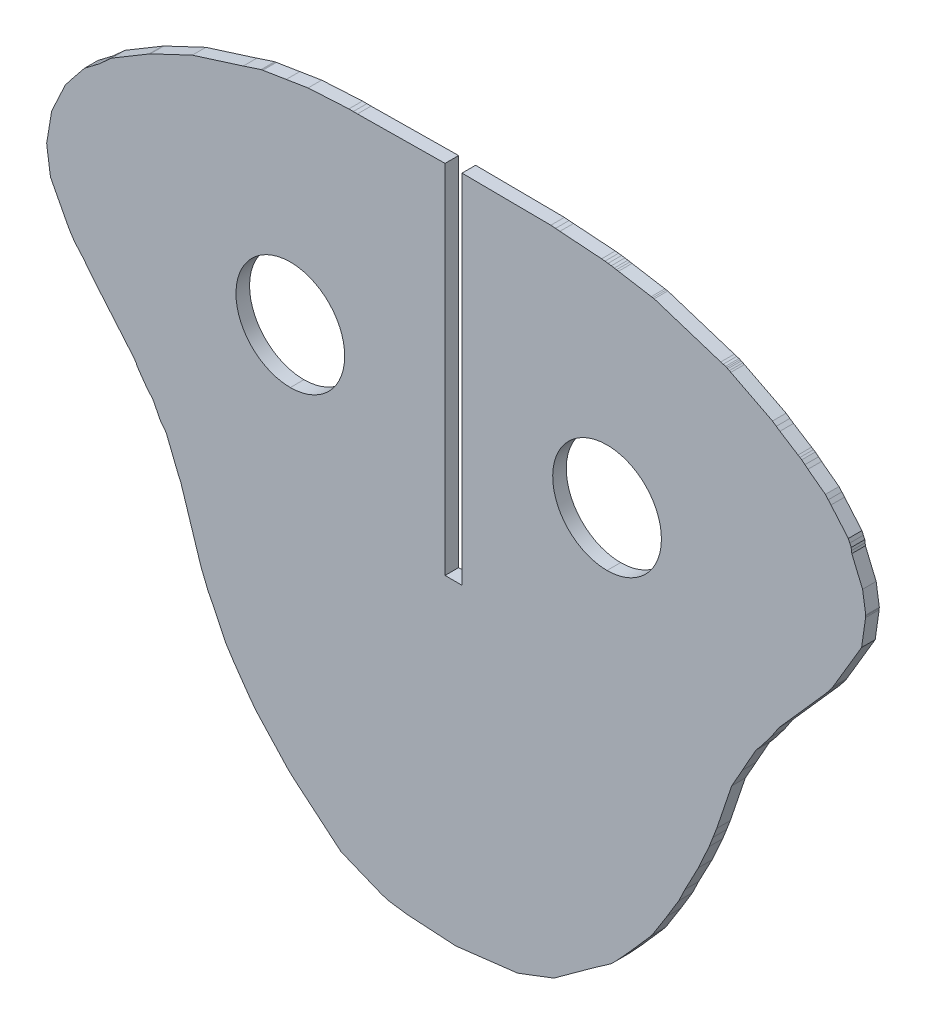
SolidWorks part; units mm, degrees
ref_plane "Спереди" through (0, 0, 0) normal (0, 0, 1) x (1, 0, 0)
ref_plane "Сверху" through (0, 0, 0) normal (0, 1, 0) x (1, 0, 0)
ref_plane "Справа" through (0, 0, 0) normal (1, 0, 0) x (0, 0, -1)
sketch "Model" plane through (0, 0, 0) normal (0, 0, 1) x (1, 0, 0)
  line L0 (-4228.3918, -765.8908) -> (-4227.7464, -765.9433)
  line L1 (-4227.7464, -765.9433) -> (-4221.6022, -766.3754)
  line L2 (-4221.6022, -766.3754) -> (-4221.1138, -766.4289)
  line L3 (-4221.1138, -766.4289) -> (-4220.6578, -766.4789)
  line L4 (-4220.6578, -766.4789) -> (-4220.1798, -766.5504)
  line L5 (-4220.1798, -766.5504) -> (-4219.7333, -766.6173)
  line L6 (-4219.7333, -766.6173) -> (-4219.4218, -766.6754)
  line L7 (-4219.4218, -766.6754) -> (-4219.1308, -766.7299)
  line L8 (-4219.1308, -766.7299) -> (-4214.2924, -767.5387)
  line L9 (-4214.2924, -767.5387) -> (-4214.0734, -767.5724)
  line L10 (-4214.0734, -767.5724) -> (-4213.8685, -767.6042)
  line L11 (-4213.8685, -767.6042) -> (-4204.0663, -770.7607)
  line L12 (-4204.0663, -770.7607) -> (-4203.7112, -770.8678)
  line L13 (-4203.7112, -770.8678) -> (-4203.3777, -770.9687)
  line L14 (-4203.3777, -770.9687) -> (-4203.2023, -771.0421)
  line L15 (-4203.2023, -771.0421) -> (-4203.0374, -771.1115)
  line L16 (-4203.0374, -771.1115) -> (-4202.8036, -771.2321)
  line L17 (-4202.8036, -771.2321) -> (-4202.5838, -771.3456)
  line L18 (-4202.5838, -771.3456) -> (-4196.4529, -774.4787)
  line L19 (-4196.4529, -774.4787) -> (-4195.8908, -774.8703)
  line L20 (-4195.8908, -774.8703) -> (-4195.3596, -775.2401)
  line L21 (-4195.3596, -775.2401) -> (-4192.6938, -776.9335)
  line L22 (-4192.6938, -776.9335) -> (-4192.411, -777.1046)
  line L23 (-4192.411, -777.1046) -> (-4192.1429, -777.2665)
  line L24 (-4192.1429, -777.2665) -> (-4191.6747, -777.6547)
  line L25 (-4191.6747, -777.6547) -> (-4191.2305, -778.0231)
  line L26 (-4191.2305, -778.0231) -> (-4188.6674, -779.9355)
  line L27 (-4188.6674, -779.9355) -> (-4188.2435, -780.4179)
  line L28 (-4188.2435, -780.4179) -> (-4187.8398, -780.8771)
  line L29 (-4187.8398, -780.8771) -> (-4185.2854, -783.8681)
  line L30 (-4185.2854, -783.8681) -> (-4185.073, -784.3488)
  line L31 (-4185.073, -784.3488) -> (-4184.8697, -784.8092)
  line L32 (-4184.8697, -784.8092) -> (-4184.8192, -785.185)
  line L33 (-4184.8192, -785.185) -> (-4184.7709, -785.5453)
  line L34 (-4184.7709, -785.5453) -> (-4183.1897, -789.2968)
  line L35 (-4183.1897, -789.2968) -> (-4182.7238, -792.3534)
  line L36 (-4182.7238, -792.3534) -> (-4182.7305, -792.4281)
  line L37 (-4182.7305, -792.4281) -> (-4182.737, -792.5004)
  line L38 (-4182.737, -792.5004) -> (-4182.7465, -792.6867)
  line L39 (-4182.7465, -792.6867) -> (-4183.3308, -796.7895)
  line L40 (-4183.3308, -796.7895) -> (-4187.5105, -803.8466)
  line L41 (-4187.5105, -803.8466) -> (-4187.6112, -804.0138)
  line L42 (-4187.6112, -804.0138) -> (-4187.7103, -804.1784)
  line L43 (-4187.7103, -804.1784) -> (-4188.6076, -805.3053)
  line L44 (-4188.6076, -805.3053) -> (-4195.4706, -813.059)
  line L45 (-4195.4706, -813.059) -> (-4196.6727, -814.8629)
  line L46 (-4196.6727, -814.8629) -> (-4198.13, -816.7629)
  line L47 (-4198.13, -816.7629) -> (-4198.9062, -817.6806)
  line L48 (-4198.9062, -817.6806) -> (-4200.8898, -821.2216)
  line L49 (-4200.8898, -821.2216) -> (-4202.4613, -824.006)
  line L50 (-4202.4613, -824.006) -> (-4204.6601, -830.5229)
  line L51 (-4204.6601, -830.5229) -> (-4205.2132, -831.9425)
  line L52 (-4205.2132, -831.9425) -> (-4205.7795, -833.3964)
  line L53 (-4205.7795, -833.3964) -> (-4207.3495, -836.872)
  line L54 (-4207.3495, -836.872) -> (-4209.3335, -840.644)
  line L55 (-4209.3335, -840.644) -> (-4210.2274, -842.5021)
  line L56 (-4210.2274, -842.5021) -> (-4211.9523, -845.3485)
  line L57 (-4211.9523, -845.3485) -> (-4214.1377, -848.8188)
  line L58 (-4214.1377, -848.8188) -> (-4214.4244, -849.162)
  line L59 (-4214.4244, -849.162) -> (-4214.725, -849.5219)
  line L60 (-4214.725, -849.5219) -> (-4217.6237, -852.8183)
  line L61 (-4217.6237, -852.8183) -> (-4219.506, -854.851)
  line L62 (-4219.506, -854.851) -> (-4219.834, -855.1816)
  line L63 (-4219.834, -855.1816) -> (-4220.1809, -855.5309)
  line L64 (-4220.1809, -855.5309) -> (-4220.9488, -856.0722)
  line L65 (-4220.9488, -856.0722) -> (-4221.7621, -856.6452)
  line L66 (-4221.7621, -856.6452) -> (-4221.9884, -856.7939)
  line L67 (-4221.9884, -856.7939) -> (-4222.2284, -856.9518)
  line L68 (-4222.2284, -856.9518) -> (-4228.5113, -861.506)
  line L69 (-4228.5113, -861.506) -> (-4228.632, -861.5717)
  line L70 (-4228.632, -861.5717) -> (-4228.7609, -861.6418)
  line L71 (-4228.7609, -861.6418) -> (-4233.1522, -863.3234)
  line L72 (-4233.1522, -863.3234) -> (-4233.5634, -863.4716)
  line L73 (-4233.5634, -863.4716) -> (-4234.0035, -863.63)
  line L74 (-4234.0035, -863.63) -> (-4242.5676, -864.6535)
  line L75 (-4242.5676, -864.6535) -> (-4242.7355, -864.672)
  line L76 (-4242.7355, -864.672) -> (-4242.9154, -864.6921)
  line L77 (-4242.9154, -864.6921) -> (-4243.0228, -864.6991)
  line L78 (-4243.0228, -864.6991) -> (-4243.1307, -864.6996)
  line L79 (-4243.1307, -864.6996) -> (-4243.2463, -864.7001)
  line L80 (-4243.2463, -864.7001) -> (-4246.6624, -864.4928)
  line L81 (-4246.6624, -864.4928) -> (-4250.3232, -864.2712)
  line L82 (-4250.3232, -864.2712) -> (-4251.63, -864.079)
  line L83 (-4251.63, -864.079) -> (-4253.0297, -863.873)
  line L84 (-4253.0297, -863.873) -> (-4253.483, -863.7355)
  line L85 (-4253.483, -863.7355) -> (-4253.9683, -863.5885)
  line L86 (-4253.9683, -863.5885) -> (-4259.8354, -861.195)
  line L87 (-4259.8354, -861.195) -> (-4259.8889, -861.173)
  line L88 (-4259.8889, -861.173) -> (-4259.9459, -861.1493)
  line L89 (-4259.9459, -861.1493) -> (-4259.9636, -861.1376)
  line L90 (-4259.9636, -861.1376) -> (-4259.9825, -861.1252)
  line L91 (-4259.9825, -861.1252) -> (-4260.0657, -861.0561)
  line L92 (-4260.0657, -861.0561) -> (-4260.1545, -860.9823)
  line L93 (-4260.1545, -860.9823) -> (-4266.8943, -855.3258)
  line L94 (-4266.8943, -855.3258) -> (-4267.3085, -854.9484)
  line L95 (-4267.3085, -854.9484) -> (-4267.7465, -854.5495)
  line L96 (-4267.7465, -854.5495) -> (-4268.0569, -854.2118)
  line L97 (-4268.0569, -854.2118) -> (-4268.3846, -853.8549)
  line L98 (-4268.3846, -853.8549) -> (-4272.4128, -849.4909)
  line L99 (-4272.4128, -849.4909) -> (-4273.3473, -848.2685)
  line L100 (-4273.3473, -848.2685) -> (-4275.7136, -844.8908)
  line L101 (-4275.7136, -844.8908) -> (-4276.9024, -843.0653)
  line L102 (-4276.9024, -843.0653) -> (-4278.5817, -839.5512)
  line L103 (-4278.5817, -839.5512) -> (-4279.5336, -837.6825)
  line L104 (-4279.5336, -837.6825) -> (-4280.5584, -835.1754)
  line L105 (-4280.5584, -835.1754) -> (-4283.5931, -825.7138)
  line L106 (-4283.5931, -825.7138) -> (-4283.7041, -825.5087)
  line L107 (-4283.7041, -825.5087) -> (-4283.8168, -825.3007)
  line L108 (-4283.8168, -825.3007) -> (-4285.7033, -820.5907)
  line L109 (-4285.7033, -820.5907) -> (-4286.5549, -819.4787)
  line L110 (-4286.5549, -819.4787) -> (-4287.6427, -817.3451)
  line L111 (-4287.6427, -817.3451) -> (-4288.6038, -816.2145)
  line L112 (-4288.6038, -816.2145) -> (-4289.1098, -815.5009)
  line L113 (-4289.1098, -815.5009) -> (-4289.9613, -814.2838)
  line L114 (-4289.9613, -814.2838) -> (-4290.0612, -814.0544)
  line L115 (-4290.0612, -814.0544) -> (-4290.1609, -813.8251)
  line L116 (-4290.1609, -813.8251) -> (-4290.4326, -813.4733)
  line L117 (-4290.4326, -813.4733) -> (-4290.7037, -813.1225)
  line L118 (-4290.7037, -813.1225) -> (-4296.3263, -806.465)
  line L119 (-4296.3263, -806.465) -> (-4297.9647, -804.3778)
  line L120 (-4297.9647, -804.3778) -> (-4299.1771, -803.0102)
  line L121 (-4299.1771, -803.0102) -> (-4299.8458, -802.007)
  line L122 (-4299.8458, -802.007) -> (-4300.0612, -801.6225)
  line L123 (-4300.0612, -801.6225) -> (-4300.2725, -801.2448)
  line L124 (-4300.2725, -801.2448) -> (-4302.7076, -796.5754)
  line L125 (-4302.7076, -796.5754) -> (-4302.7225, -796.5448)
  line L126 (-4302.7225, -796.5448) -> (-4302.737, -796.5153)
  line L127 (-4302.737, -796.5153) -> (-4302.7427, -796.4814)
  line L128 (-4302.7427, -796.4814) -> (-4302.7482, -796.4482)
  line L129 (-4302.7482, -796.4482) -> (-4303.2784, -792.7004)
  line L130 (-4303.2784, -792.7004) -> (-4303.2872, -792.5663)
  line L131 (-4303.2872, -792.5663) -> (-4303.2958, -792.4367)
  line L132 (-4303.2958, -792.4367) -> (-4303.2623, -792.2614)
  line L133 (-4303.2623, -792.2614) -> (-4303.2299, -792.0912)
  line L134 (-4303.2299, -792.0912) -> (-4302.5599, -788.0072)
  line L135 (-4302.5599, -788.0072) -> (-4300.9384, -784.5229)
  line L136 (-4300.9384, -784.5229) -> (-4300.6015, -783.7597)
  line L137 (-4300.6015, -783.7597) -> (-4299.6193, -782.4897)
  line L138 (-4299.6193, -782.4897) -> (-4297.7258, -780.1413)
  line L139 (-4297.7258, -780.1413) -> (-4296.6209, -779.3024)
  line L140 (-4296.6209, -779.3024) -> (-4295.5702, -778.5046)
  line L141 (-4295.5702, -778.5046) -> (-4294.6397, -777.6679)
  line L142 (-4294.6397, -777.6679) -> (-4293.7568, -776.8744)
  line L143 (-4293.7568, -776.8744) -> (-4288.2402, -773.5819)
  line L144 (-4288.2402, -773.5819) -> (-4288.1721, -773.5402)
  line L145 (-4288.1721, -773.5402) -> (-4288.1079, -773.5009)
  line L146 (-4288.1079, -773.5009) -> (-4288.0735, -773.4828)
  line L147 (-4288.0735, -773.4828) -> (-4288.041, -773.4657)
  line L148 (-4288.041, -773.4657) -> (-4281.8587, -770.5414)
  line L149 (-4281.8587, -770.5414) -> (-4274.3558, -768.1733)
  line L150 (-4274.3558, -768.1733) -> (-4271.7405, -767.3202)
  line L151 (-4271.7405, -767.3202) -> (-4271.6018, -767.297)
  line L152 (-4271.6018, -767.297) -> (-4271.4722, -767.2755)
  line L153 (-4271.4722, -767.2755) -> (-4268.0326, -766.7209)
  line L154 (-4268.0326, -766.7209) -> (-4264.8195, -766.2023)
  line L155 (-4264.8195, -766.2023) -> (-4258.8132, -765.8691)
  line L156 (-4258.8132, -765.8691) -> (-4258.158, -765.8747)
  line L157 (-4258.158, -765.8747) -> (-4257.5466, -765.8798)
  line L158 (-4257.5466, -765.8798) -> (-4244.6525, -765.7359)
  line L159 (-4244.6525, -765.7359) -> (-4244.6525, -818.2719)
  line L160 (-4244.6525, -818.2719) -> (-4244.4025, -818.2719)
  line L161 (-4244.4025, -818.2719) -> (-4242.4025, -818.2719)
  line L162 (-4242.4025, -818.2719) -> (-4242.1525, -818.2719)
  line L163 (-4242.1525, -818.2719) -> (-4242.1525, -765.7237)
  line L164 (-4242.1525, -765.7237) -> (-4229.0834, -765.8344)
  line L165 (-4229.0834, -765.8344) -> (-4228.3918, -765.8908)
  spline S0 degree 3 poles (-4220.8047, -805.7065) (-4216.3864, -805.7065) (-4212.8047, -802.1247) (-4212.8047, -797.7065) (-4212.8047, -793.2882) (-4216.3864, -789.7065) (-4220.8047, -789.7065) knots 0.5 0.5 0.5 0.5 0.75 0.75 0.75 1 1 1 1
  spline S1 degree 3 poles (-4220.8047, -789.7065) (-4225.223, -789.7065) (-4228.8047, -793.2882) (-4228.8047, -797.7065) (-4228.8047, -802.1247) (-4225.223, -805.7065) (-4220.8047, -805.7065) knots 0 0 0 0 0.25 0.25 0.25 0.5 0.5 0.5 0.5
  spline S2 degree 3 poles (-4267.429, -805.7001) (-4263.0107, -805.7001) (-4259.429, -802.1184) (-4259.429, -793.2818) (-4263.0107, -789.7001) (-4267.429, -789.7001) knots 0.5 0.5 0.5 0.5 0.75 0.75 1 1 1 1
  spline S3 degree 3 poles (-4267.429, -789.7001) (-4271.8473, -789.7001) (-4275.429, -793.2818) (-4275.429, -802.1184) (-4271.8473, -805.7001) (-4267.429, -805.7001) knots 0 0 0 0 0.25 0.25 0.5 0.5 0.5 0.5
extrude "Бобышка-Вытянуть1" add sketch "Model" along normal blind 2
